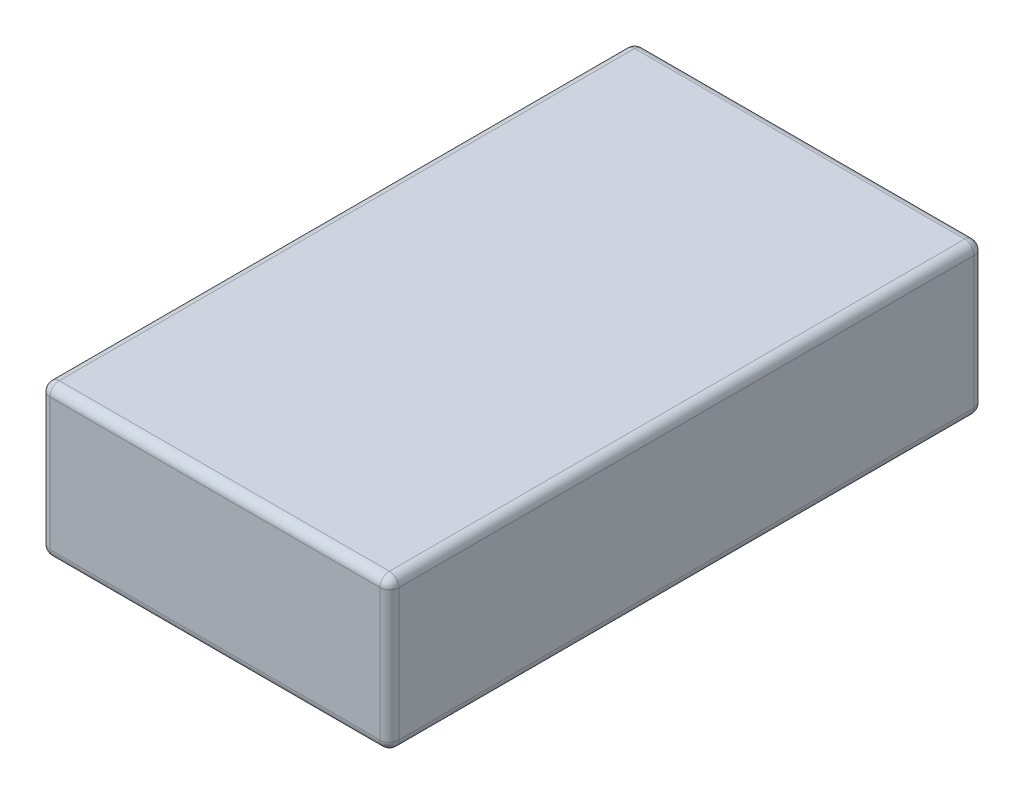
SolidWorks part; units mm, degrees
ref_plane "Plan de face" through (0, 0, 0) normal (0, 0, 1) x (1, 0, 0)
ref_plane "Plan de dessus" through (0, 0, 0) normal (0, 1, 0) x (1, 0, 0)
ref_plane "Plan de droite" through (0, 0, 0) normal (1, 0, 0) x (0, 0, -1)
sketch "Esquisse1" plane through (0, 0, 0) normal (0, 1, 0) x (1, 0, 0)
  line L1 (0, 0) -> (37, 0)
  line L2 (0, 0) -> (0, 63)
  line L3 (0, 63) -> (37, 63)
  line L4 (37, 0) -> (37, 63)
extrude "Extrusion1" add sketch "Esquisse1" along normal blind 16
sketch "Esquisse2" plane through (0, 0, 0) normal (0, -1, 0) x (1, 0, 0)
  line L0 (43.7585, -3) -> (-4.2173, -3) construction
  line L1 (43.7585, -7) -> (8.797, -7) construction
  line L2 (28, -1.1975) -> (28, -11.6705) construction
  line L3 (20, 2.2679) -> (20, -13.2877) construction
  line L4 (37, 0) -> (37, -63) construction
  line L5 (0, 0) -> (37, 0) construction
  line L7 (20, -3) -> (28, -3)
  line L8 (20, -3) -> (20, -7)
  line L9 (20, -7) -> (28, -7)
  line L10 (28, -3) -> (28, -7)
  dimension "D1" = 17
  dimension "D2" = 7
  dimension "D3" = 8
  dimension "D4" = 4
extrude "Enlèv. mat.-Extru.1" cut sketch "Esquisse2" against normal blind 2.5
sketch "Esquisse3" plane through (0, 2.5, 0) normal (0, -1, 0) x (1, 0, 0)
  line L0 (28, -3) -> (20, -3) construction
  line L1 (20.2, -3.5) -> (23.2, -3.5)
  line L2 (20.2, -3.5) -> (20.2, -6.5)
  line L3 (20.2, -6.5) -> (23.2, -6.5)
  line L4 (23.2, -3.5) -> (23.2, -6.5)
  line L5 (20, -3) -> (20, -7) construction
  dimension "D1" = 0.5
  dimension "D2" = 0.2
extrude "Extrusion2" add sketch "Esquisse3" along normal blind 4.5
fillet "Congé1" radius 1 12 edges at (0, 0, -31.5) (18.5, 0, -63) (0, 8, -63) (0, 8, 0) (18.5, 0, 0) (37, 8, 0) (37, 0, -31.5) (37, 8, -63) (18.5, 16, -63) (0, 16, -31.5) (18.5, 16, 0) (37, 16, -31.5)
